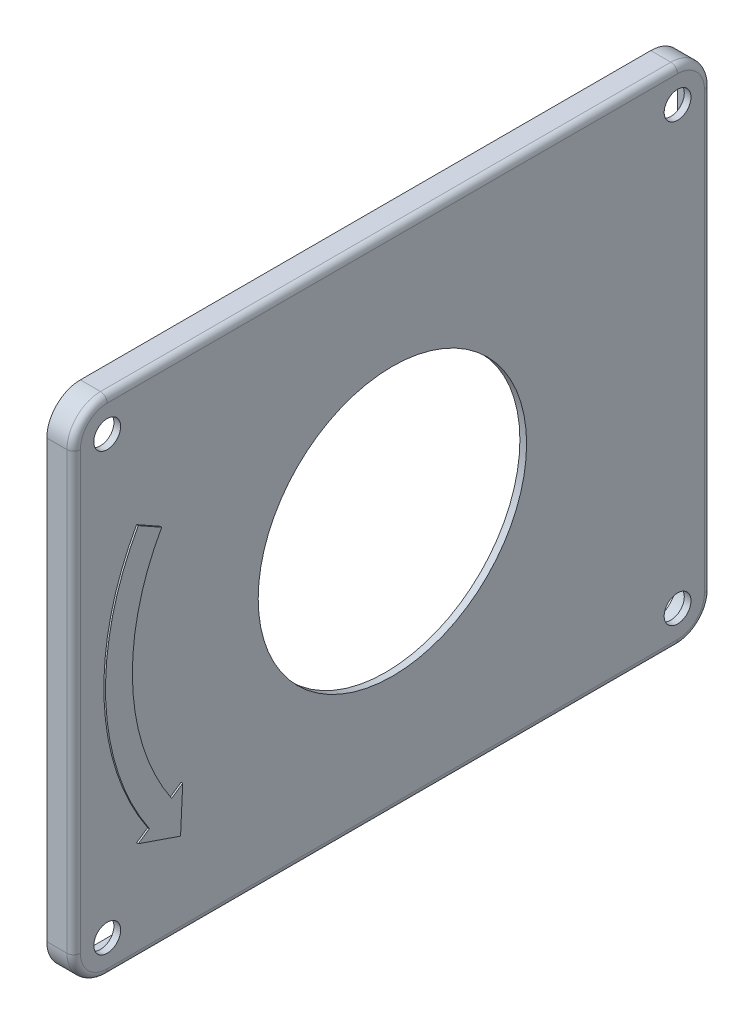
SolidWorks part; units mm, degrees
ref_plane "Front Plane" through (0, 0, 0) normal (0, 0, 1) x (1, 0, 0)
ref_plane "Top Plane" through (0, 0, 0) normal (0, 1, 0) x (1, 0, 0)
ref_plane "Right Plane" through (0, 0, 0) normal (1, 0, 0) x (0, 0, -1)
sketch "Sketch1" plane through (0, 0, 0) normal (1, 0, 0) x (0, 0, -1)
  line L1 (-42.5, 37.5) -> (42.5, 37.5)
  line L2 (-47.5, 32.5) -> (-47.5, -32.5)
  line L3 (-42.5, -37.5) -> (42.5, -37.5)
  line L4 (47.5, 32.5) -> (47.5, -32.5)
  line L5 (-47.5, 37.5) -> (47.5, -37.5) construction
  line L6 (-47.5, -37.5) -> (47.5, 37.5) construction
  arc A0 (42.5, -37.5) -> (47.5, -32.5) centre (42.5, -32.5) ccw
  arc A1 (42.5, 37.5) -> (47.5, 32.5) centre (42.5, 32.5) cw
  arc A2 (-42.5, 37.5) -> (-47.5, 32.5) centre (-42.5, 32.5) ccw
  arc A3 (-47.5, -32.5) -> (-42.5, -37.5) centre (-42.5, -32.5) ccw
  circle A4 centre (-42.5, 32.5) radius 2
  circle A5 centre (-42.5, -32.5) radius 2
  circle A6 centre (42.5, -32.5) radius 2
  circle A7 centre (42.5, 32.5) radius 2
  circle A8 centre (0, 0) radius 20
  point P0 (0, 0)
  dimension "D3" = 5
  dimension "D4" = 4
  dimension "D5" = 40
  dimension "D1" = 95
  dimension "D2" = 75
extrude "Boss-Extrude1" add sketch "Sketch1" along normal mid plane 4
fillet "Fillet1" radius 1 8 edges at (2, 36.0355, -46.0355) (2, 0, -47.5) (2, -36.0355, -46.0355) (2, -37.5, 0) (2, -36.0355, 46.0355) (2, 0, 47.5) (2, 36.0355, 46.0355) (2, 37.5, 0)
shell "Shell1" thickness 1
other "DeleteFace2"
sketch "Sketch2" plane through (2, 0, 0) normal (1, 0, 0) x (0, 0, -1)
  line L0 (-31.4959, -17.9434) -> (-31.8193, -24.5994)
  line L1 (-36.4639, -21.3078) -> (-38.1199, -22.4292)
  line L2 (-34.8079, -20.1863) -> (-31.8193, -24.5994) construction
  line L3 (-38.1199, -22.4292) -> (-31.8193, -24.5994)
  line L4 (-33.1519, -19.0648) -> (-31.4959, -17.9434)
  line L5 (-34.6336, 16.6688) -> (-38.1199, 18.6298)
  arc A0 (-34.6336, 16.6688) -> (-33.1519, -19.0648) centre (-5, 0) ccw
  arc A1 (-38.1199, 18.6298) -> (-36.4639, -21.3078) centre (-5, 0) ccw
extrude "Boss-Extrude2" add sketch "Sketch2" along normal blind 0.25
